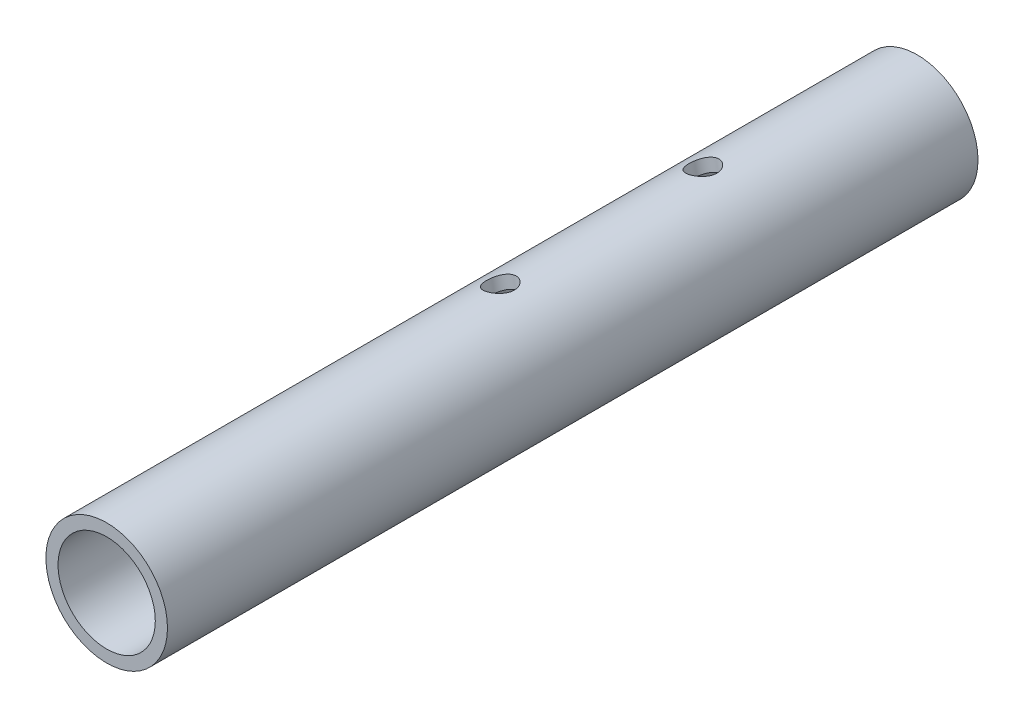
SolidWorks part; units mm, degrees
ref_plane "Plan de face" through (0, 0, 0) normal (0, 0, 1) x (1, 0, 0)
ref_plane "Plan de dessus" through (0, 0, 0) normal (0, 1, 0) x (1, 0, 0)
ref_plane "Plan de droite" through (0, 0, 0) normal (1, 0, 0) x (0, 0, -1)
sketch "Esquisse1" plane through (0, 0, 0) normal (0, 0, 1) x (1, 0, 0)
  circle A0 centre (-10.4242, -1.5385) radius 12
  circle A1 centre (-10.4242, -1.5385) radius 15
  dimension "D1" = 24
  dimension "D2" = 30
extrude "Boss.-Extru.1" add sketch "Esquisse1" along normal blind 200
sketch3d "Esquisse3D1" plane through (0, 0, 0) normal (0, 0, 1) x (1, 0, 0)
sketch "Esquisse2" plane through (2.8264, -14.1945, 0) normal (0.1953, -0.9807, 0) x (0.9807, 0.1953, 0)
  line L0 (-25.5239, 0) -> (4.4761, 0) construction
  circle A0 centre (-10.5239, 100) radius 3.5
  circle A1 centre (-10.5239, 50) radius 3.5
  dimension "D1" = 7
  dimension "D4" = 7
  dimension "D2" = 100
  dimension "D3" = 50
extrude "Enlèv. mat.-Extru.1" cut sketch "Esquisse2" against normal through all
